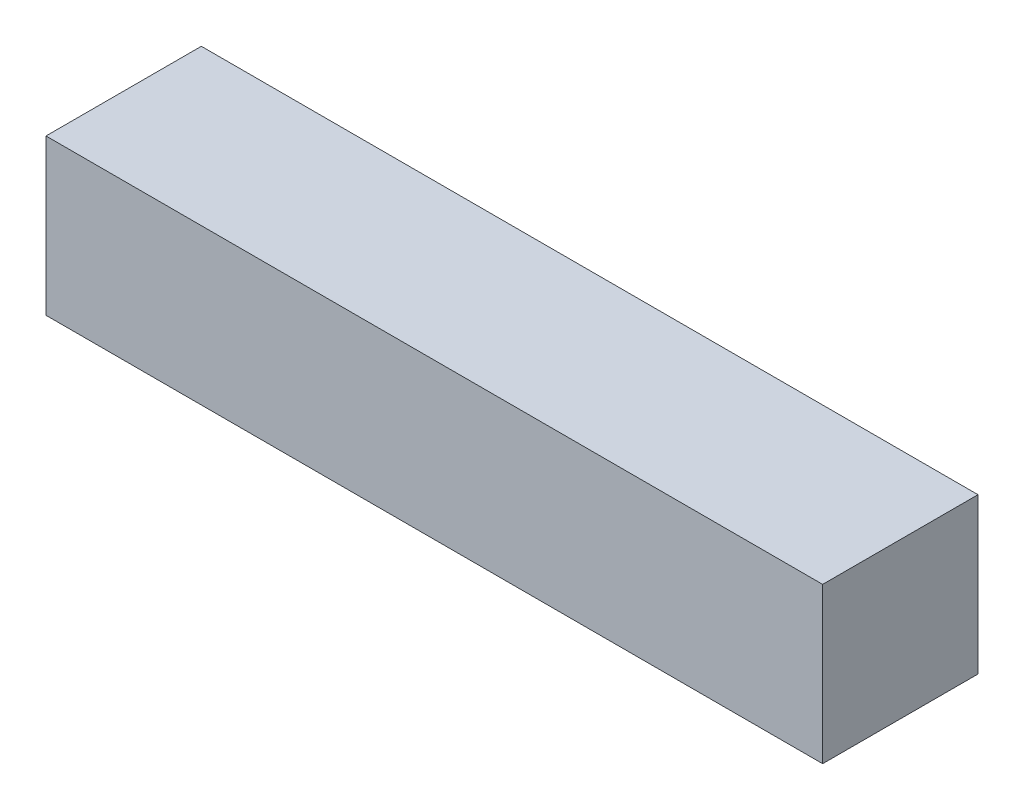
SolidWorks part; units mm, degrees
ref_plane "前视基准面" through (0, 0, 0) normal (0, 0, 1) x (1, 0, 0)
ref_plane "上视基准面" through (0, 0, 0) normal (0, 1, 0) x (1, 0, 0)
ref_plane "右视基准面" through (0, 0, 0) normal (1, 0, 0) x (0, 0, -1)
other "Configuration Table"
sketch "草图1" plane through (0, 0, 0) normal (0, 0, 1) x (1, 0, 0)
  line L1 (200, -40) -> (-200, -40)
  line L2 (200, -40) -> (200, 40)
  line L3 (200, 40) -> (-200, 40)
  line L4 (-200, -40) -> (-200, 40)
  line L5 (200, -40) -> (-200, 40) construction
  line L6 (200, 40) -> (-200, -40) construction
  point P0 (0, 0)
  dimension "D1" = 80
  dimension "D2" = 400
extrude "凸台-拉伸1" add sketch "草图1" along normal blind 80
